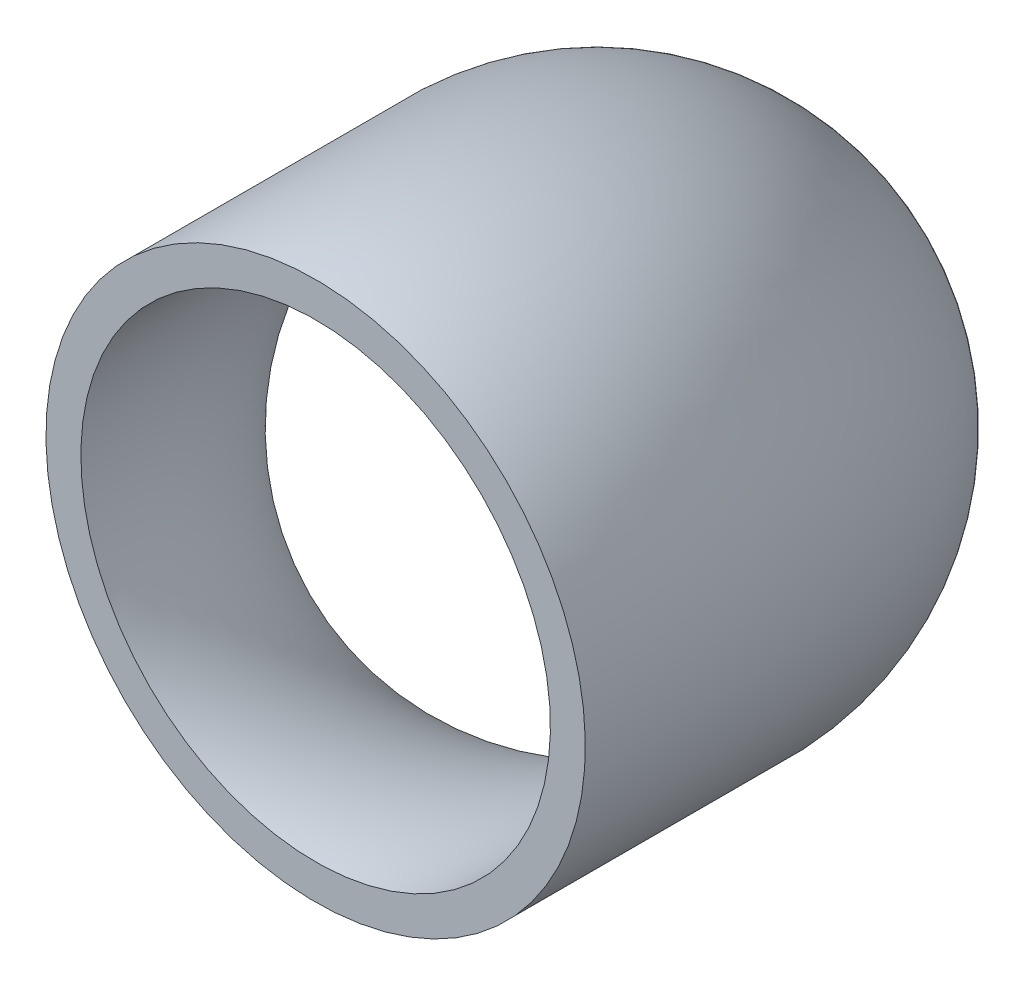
SolidWorks part; units mm, degrees
ref_plane "Front" through (0, 0, 0) normal (0, 0, 1) x (1, 0, 0)
ref_plane "Top" through (0, 0, 0) normal (0, 1, 0) x (1, 0, 0)
ref_plane "Side" through (0, 0, 0) normal (1, 0, 0) x (0, 0, -1)
sketch "PipeSketch"
  dimension "OuterDiameter" = 60.452
  dimension "InnerDiameter" = 52.6288
sketch "FilterSketch" plane through (0, 0, 0) normal (0, 0, 1) x (1, 0, 0)
  circle A0 centre (0, 0) radius 25.4 construction
  dimension "NominalDiameter" = 50.8
sketch3d "3DSketch1"
  arc A0 (0, 0, 0) -> (-43.1052, -43.1052, -60.96) centre (-43.1052, -43.1052, 0) ccw construction
  arc A1 (0, 0, 0) -> (-43.1052, -43.1052, -60.96) centre (-43.1052, -43.1052, 0) ccw
  point P3 (-86.2105, 0, 0)
  point P4 (-86.2105, 0, 0)
sweep "Sweep1" add profiles "PipeSketch" path "3DSketch1"
